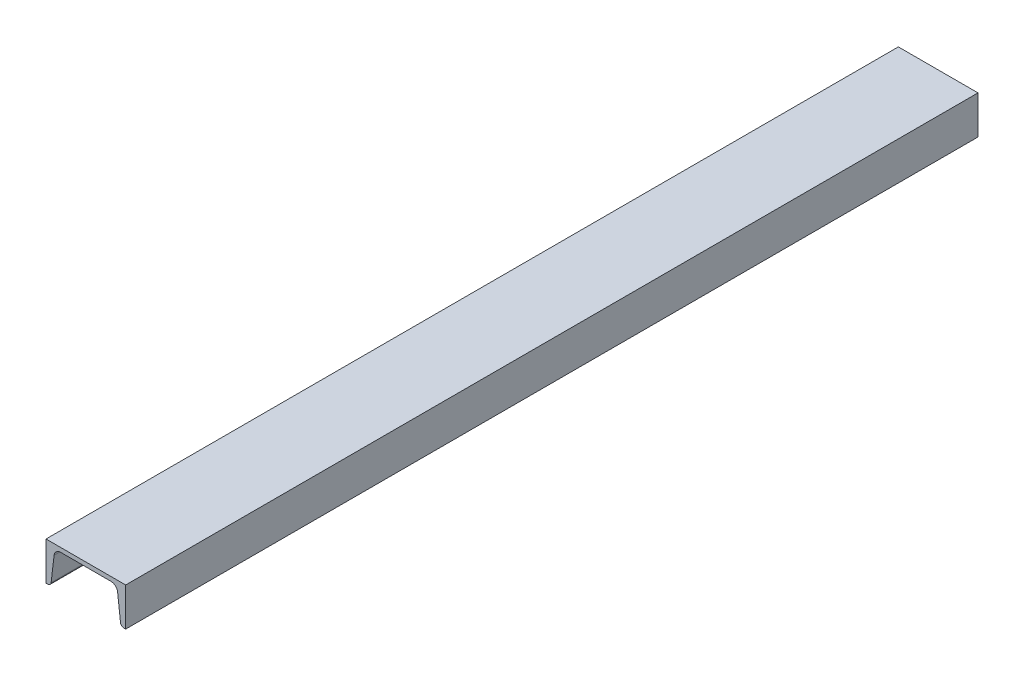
SolidWorks part; units mm, degrees
ref_plane "前视基准面" through (0, 0, 0) normal (0, 0, 1) x (1, 0, 0)
ref_plane "上视基准面" through (0, 0, 0) normal (0, 1, 0) x (1, 0, 0)
ref_plane "右视基准面" through (0, 0, 0) normal (1, 0, 0) x (0, 0, -1)
sketch "草图1" plane through (0, 0, 0) normal (0, 0, 1) x (1, 0, 0)
  line L0 (-50, 0) -> (50, 0)
  line L1 (50, 0) -> (50, -48)
  line L2 (50, -48) -> (47.8259, -48)
  line L3 (43.555, -44.2001) -> (39.8796, -12.8114)
  line L4 (31.4372, -5.3) -> (-31.4372, -5.3)
  line L5 (-39.8796, -12.8114) -> (-43.555, -44.2001)
  line L6 (-47.8259, -48) -> (-50, -48)
  line L7 (-50, -48) -> (-50, 0)
  line L8 (-50, -26.65) -> (-41.5, -26.65) construction
  line L9 (41.5, -26.65) -> (50, -26.65) construction
  arc A0 (-31.4372, -5.3) -> (-39.8796, -12.8114) centre (-31.4372, -13.8) ccw
  arc A1 (39.8796, -12.8114) -> (31.4372, -5.3) centre (31.4372, -13.8) ccw
  arc A2 (-43.555, -44.2001) -> (-47.8259, -48) centre (-47.8259, -43.7) cw
  arc A3 (47.8259, -48) -> (43.555, -44.2001) centre (47.8259, -43.7) cw
  point P19 (-44, -48)
  point P22 (44, -48)
  dimension "D11" = 8.5
  dimension "D12" = 4.3
  dimension "D1" = 100
  dimension "D2" = 48
  dimension "D3" = 5.3
  dimension "D4" = 48
  dimension "D5" = 6
  dimension "D6" = 6
  dimension "D7" = 50
  dimension "D8" = 21.35
  dimension "D9" = 8.5
  dimension "D10" = 8.5
extrude "拉伸1" add sketch "草图1" along normal blind 1070
